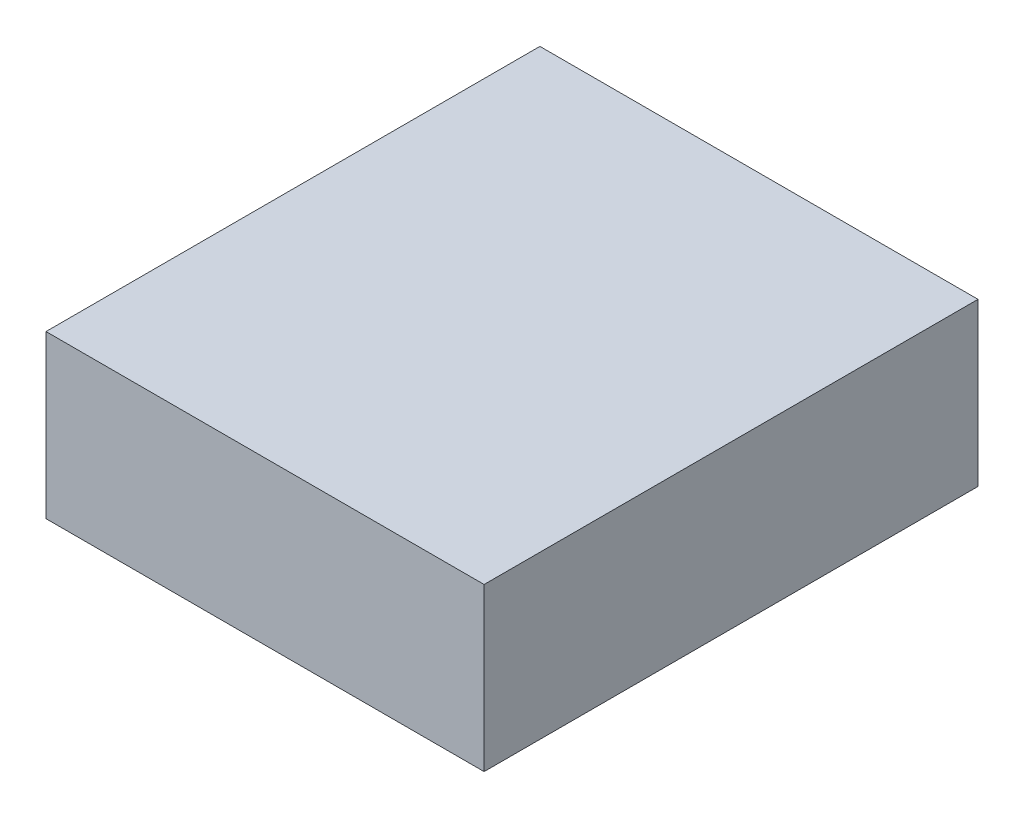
SolidWorks part; units mm, degrees
ref_plane "Front Plane" through (0, 0, 0) normal (0, 0, 1) x (1, 0, 0)
ref_plane "Top Plane" through (0, 0, 0) normal (0, 1, 0) x (1, 0, 0)
ref_plane "Right Plane" through (0, 0, 0) normal (1, 0, 0) x (0, 0, -1)
sketch "Sketch1" plane through (0, 0, 0) normal (0, 0, 1) x (1, 0, 0)
  line L1 (-63.7085, 199.4188) -> (65.4879, 199.4188)
  line L2 (-63.7085, 199.4188) -> (-63.7085, 151.624)
  line L3 (-63.7085, 151.624) -> (65.4879, 151.624)
  line L4 (65.4879, 199.4188) -> (65.4879, 151.624)
extrude "Boss-Extrude1" add sketch "Sketch1" along normal blind 140.6497 and the other way blind 5
